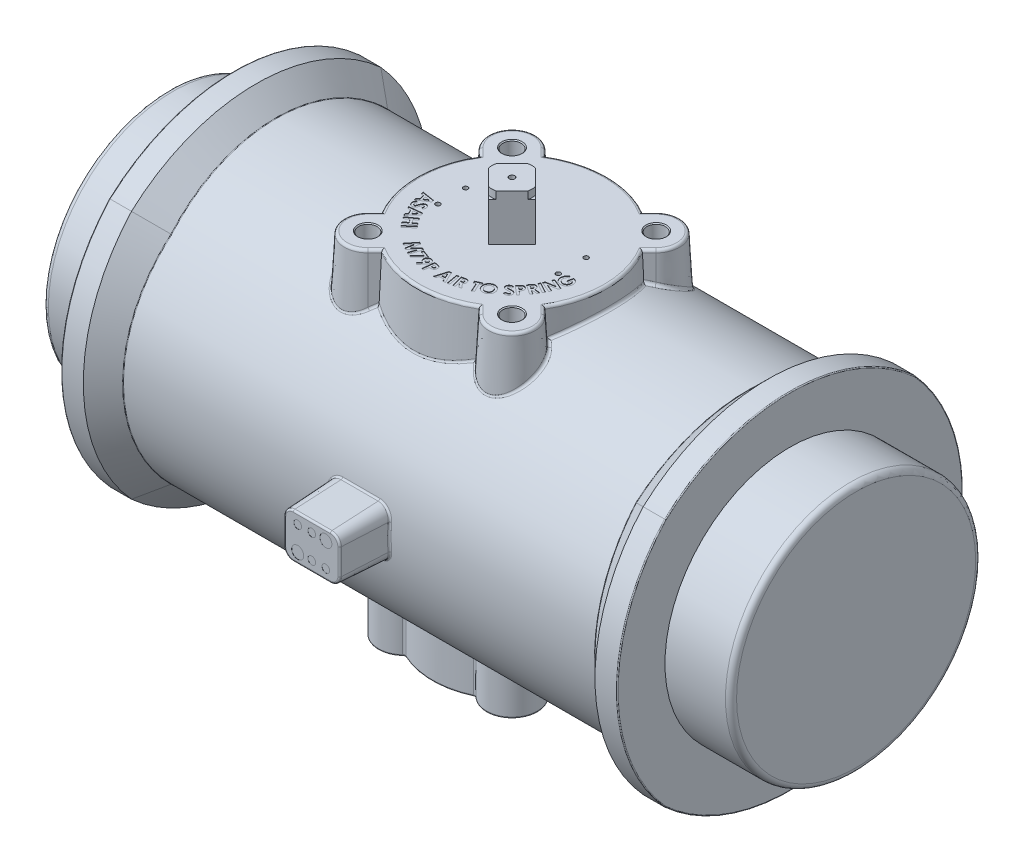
SolidWorks part; units mm, degrees
ref_plane "Front" through (0, 0, 0) normal (0, 0, 1) x (1, 0, 0)
ref_plane "Top" through (0, 0, 0) normal (0, 1, 0) x (1, 0, 0)
ref_plane "Right" through (0, 0, 0) normal (1, 0, 0) x (0, 0, -1)
ref_plane "Plane1" through (300, 0, 0) normal (1, 0, 0) x (0, 0, -1)
sketch "Sketch1" plane through (300, 0, 0) normal (1, 0, 0) x (0, 0, -1)
  line L0 (0, 0) -> (0, 212.9659) construction
  line L1 (0, 0) -> (110.8256, 0) construction
  line L2 (0, 186.5) -> (99.986, 186.5) construction
  line L3 (186.5, 0) -> (186.5, 111.5731) construction
  line L4 (0, 0) -> (-121.6652, 0) construction
  line L5 (0, 0) -> (0, -113.0682) construction
  arc A0 (-134.5102, -134.5102) -> (-134.5102, 134.5102) centre (13.5, 0) cw
  arc A1 (134.5102, -134.5102) -> (134.5102, 134.5102) centre (-13.5, 0) ccw
  arc A2 (134.5102, 134.5102) -> (-134.5102, 134.5102) centre (0, -13.5) ccw
  arc A3 (134.5102, -134.5102) -> (-134.5102, -134.5102) centre (0, 13.5) cw
  dimension "D3" = 200
  dimension "D4" = 400
  dimension "D1" = 186.5
  dimension "D2" = 186.5
extrude "Extrude1" add sketch "Sketch1" against normal blind 24
sketch "Sketch2" plane through (0, 0, 0) normal (1, 0, 0) x (0, 0, -1)
  circle A0 centre (0, 0) radius 165
  dimension "D1" = 330
extrude "Extrude2" add sketch "Sketch2" along normal mid plane 600
mirror "Mirror1" about plane through (0, 0, 0) normal (1, 0, 0) of "Extrude1"
ref_plane "Plane2" through (371.25, 0, 0) normal (1, 0, 0) x (0, 0, -1)
sketch "Sketch3" plane through (371.25, 0, 0) normal (1, 0, 0) x (0, 0, -1)
  circle A0 centre (0, 0) radius 135
  dimension "D1" = 270
extrude "Extrude3" add sketch "Sketch3" against normal blind 71.25
fillet "Fillet1" radius 6 1 edges at (371.25, 0, -135)
mirror "Mirror2" about plane through (0, 0, 0) normal (1, 0, 0) of "Extrude3", "Fillet1"
sketch "Sketch4" plane through (276, 0, 0) normal (-1, 0, 0) x (0, 0, 1)
  arc A0 (-134.5102, 134.5102) -> (-134.5102, -134.5102) centre (13.5, 0) ccw construction
  arc A1 (-134.5102, -134.5102) -> (134.5102, -134.5102) centre (0, 13.5) ccw construction
  arc A2 (134.5102, -134.5102) -> (134.5102, 134.5102) centre (-13.5, 0) ccw construction
  arc A3 (134.5102, 134.5102) -> (-134.5102, 134.5102) centre (0, -13.5) ccw construction
  arc A4 (-134.5102, 134.5102) -> (-134.5102, -134.5102) centre (13.5, 0) ccw
  arc A5 (-134.5102, -134.5102) -> (134.5102, -134.5102) centre (0, 13.5) ccw
  arc A6 (134.5102, -134.5102) -> (134.5102, 134.5102) centre (-13.5, 0) ccw
  arc A7 (134.5102, 134.5102) -> (-134.5102, 134.5102) centre (0, -13.5) ccw
extrude "Extrude5" add sketch "Sketch4" along normal blind 40 draft 45
mirror "Mirror3" about plane through (0, 0, 0) normal (1, 0, 0) of "Extrude5"
fillet "Fillet7" radius 1 16 edges at (300, 0, -186.5) (300, 186.5, 0) (300, 0, 186.5) (300, -186.5, 0) (-300, -186.5, 0) (-300, 0, 186.5) (-300, 186.5, 0) (-300, 0, -186.5) (254.1974, 36.1024, 161.0019) (254.1974, -161.0019, 36.1024) (254.1974, -36.1024, -161.0019) (254.1974, 161.0019, -36.1024) (-254.1974, -161.0019, 36.1024) (-254.1974, 36.1024, 161.0019) (-254.1974, 161.0019, -36.1024) (-254.1974, -36.1024, -161.0019)
ref_plane "Plane3" through (0, -191, 0) normal (0, 1, 0) x (-1, 0, 0)
sketch "Sketch5" plane through (0, -191, 0) normal (0, 1, 0) x (-1, 0, 0)
  line L0 (0, 0) -> (0, 190.8445) construction
  line L1 (0, 0) -> (-388.587, 0) construction
  line L2 (0, 0) -> (-89.9884, 89.9884) construction
  arc A0 (77.9597, -36.3082) -> (77.9597, 36.3082) centre (0, 0) ccw
  circle A1 centre (0, 0) radius 82.5 construction
  arc A2 (-39.6168, 78.4816) -> (-78.4816, 39.6168) centre (-58.3363, 58.3363) ccw
  arc A3 (39.6168, 78.4816) -> (78.4816, 39.6168) centre (58.3363, 58.3363) cw
  arc A4 (-39.6168, -78.4816) -> (-78.4816, -39.6168) centre (-58.3363, -58.3363) cw
  arc A5 (39.6168, -78.4816) -> (78.4816, -39.6168) centre (58.3363, -58.3363) ccw
  arc A6 (36.3082, 77.9597) -> (-36.3082, 77.9597) centre (0, 0) ccw
  arc A7 (-77.9597, 36.3082) -> (-77.9597, -36.3082) centre (0, 0) ccw
  arc A8 (-36.3082, -77.9597) -> (36.3082, -77.9597) centre (0, 0) ccw
  arc A9 (36.3082, 77.9597) -> (39.6168, 78.4816) centre (37.5747, 80.6792) ccw
  arc A10 (77.9597, 36.3082) -> (78.4816, 39.6168) centre (80.6792, 37.5747) cw
  arc A11 (78.4816, -39.6168) -> (77.9597, -36.3082) centre (80.6792, -37.5747) cw
  arc A12 (36.3082, -77.9597) -> (39.6168, -78.4816) centre (37.5747, -80.6792) cw
  arc A13 (-39.6168, -78.4816) -> (-36.3082, -77.9597) centre (-37.5747, -80.6792) cw
  arc A14 (-77.9597, -36.3082) -> (-78.4816, -39.6168) centre (-80.6792, -37.5747) cw
  arc A15 (-78.4816, 39.6168) -> (-77.9597, 36.3082) centre (-80.6792, 37.5747) cw
  arc A16 (-36.3082, 77.9597) -> (-39.6168, 78.4816) centre (-37.5747, 80.6792) cw
  point P20 (38.1904, 77.0551)
  point P29 (-38.1904, -77.0551)
  point P34 (-77.0551, 38.1904)
  point P37 (-38.1904, 77.0551)
  dimension "D1" = 172
  dimension "D2" = 165
  dimension "D4" = 55
  dimension "D5" = 3
  dimension "D3" = 45
extrude "Extrude6" add sketch "Sketch5" along normal up to next
fillet "Fillet8" radius 1.5 16 edges at (0, -191, 86) (38.0421, -191, 77.7159) (77.7817, -191, 77.7817) (77.7159, -191, 38.0421) (86, -191, 0) (77.7159, -191, -38.0421) (77.7817, -191, -77.7817) (38.0421, -191, -77.7159) (0, -191, -86) (-38.0421, -191, -77.7159) (-77.7817, -191, -77.7817) (-77.7159, -191, -38.0421) (-86, -191, 0) (-77.7159, -191, 38.0421) (-77.7817, -191, 77.7817) (-38.0421, -191, 77.7159)
fillet "Fillet9" radius 3 16 edges at (-37.9049, -145.5613, 77.6975) (-73.6372, -143.6445, 81.1866) (-77.7752, -160.4868, 38.3276) (-85.2676, -164.6195, -11.1995) (-77.6853, -160.6199, -37.7657) (-77.7278, -145.4875, -77.8356) (-38.0776, -145.5484, -77.7217) (11.7776, -141.3072, -85.1897) (37.9049, -145.5613, -77.6975) (73.6372, -143.6445, -81.1866) (77.7752, -160.4868, -38.3276) (85.2676, -164.6195, 11.1995) (77.6853, -160.6199, 37.7657) (38.0776, -145.5484, 77.7217) (77.7278, -145.4875, 77.8356) (-11.7776, -141.3072, 85.1897)
sketch "Sketch6" plane through (0, -191, 0) normal (0, -1, 0) x (1, 0, 0)
  line L0 (0, 0) -> (97.1887, 0) construction
  line L1 (0, 0) -> (0, 94.8232) construction
  line L2 (0, 0) -> (86.5029, 86.5029) construction
  circle A0 centre (0, 0) radius 82.5 construction
  circle A1 centre (58.3363, 58.3363) radius 10
  circle A2 centre (-58.3363, 58.3363) radius 10
  circle A3 centre (-58.3363, -58.3363) radius 10
  circle A4 centre (58.3363, -58.3363) radius 10
  dimension "D1" = 165
  dimension "D3" = 20
  dimension "D2" = 45
extrude "Cut-Extrude1" cut sketch "Sketch6" against normal blind 40
chamfer "Chamfer1" distance 1 angle 45 4 edges at (-58.3363, -191, -68.3363) (58.3363, -191, -48.3363) (58.3363, -191, 48.3363) (-58.3363, -191, 68.3363)
sketch "Sketch7" plane through (0, -191, 0) normal (0, -1, 0) x (1, 0, 0)
  line L0 (0, 0) -> (0, 54.3411) construction
  line L1 (0, 0) -> (-43.8278, 0) construction
  line L2 (0, 0) -> (-30.8815, 30.8815) construction
  line L3 (-23, 20.0312) -> (-23, 9.5269)
  line L4 (23, 20.0312) -> (23, 9.5269)
  line L5 (-30.4277, -2.0992) -> (-23, -9.5269)
  line L6 (2.0992, 30.4277) -> (9.5269, 23)
  line L7 (30.4277, -2.0992) -> (23, -9.5269)
  line L8 (-2.0992, 30.4277) -> (-9.5269, 23)
  line L9 (-20.0312, 23) -> (-9.5269, 23)
  line L10 (-20.0312, -23) -> (-9.5269, -23)
  line L11 (9.5269, 23) -> (20.0312, 23)
  line L12 (-9.5269, -23) -> (-2.0992, -30.4277)
  line L13 (9.5269, -23) -> (2.0992, -30.4277)
  line L14 (23, 9.5269) -> (30.4277, 2.0992)
  line L15 (23, -9.5269) -> (23, -20.0312)
  line L16 (9.5269, -23) -> (20.0312, -23)
  line L17 (-23, -9.5269) -> (-23, -20.0312)
  line L18 (-23, 9.5269) -> (-30.4277, 2.0992)
  line L19 (0, 0) -> (32.2779, 32.2779) construction
  arc A1 (-20.0312, 23) -> (-23, 20.0312) centre (0, 0) ccw
  arc A2 (2.0992, 30.4277) -> (-2.0992, 30.4277) centre (0, 0) ccw
  arc A3 (23, 20.0312) -> (20.0312, 23) centre (0, 0) ccw
  arc A4 (30.4277, -2.0992) -> (30.4277, 2.0992) centre (0, 0) ccw
  arc A5 (20.0312, -23) -> (23, -20.0312) centre (0, 0) ccw
  arc A6 (-2.0992, -30.4277) -> (2.0992, -30.4277) centre (0, 0) ccw
  arc A7 (-23, -20.0312) -> (-20.0312, -23) centre (0, 0) ccw
  arc A8 (-30.4277, 2.0992) -> (-30.4277, -2.0992) centre (0, 0) ccw
  dimension "D1" = 61
  dimension "D2" = 45
  dimension "D3" = 46
  dimension "D4" = 46
  dimension "D5" = 46
  dimension "D6" = 46
  dimension "D7" = 45
extrude "Cut-Extrude2" cut sketch "Sketch7" against normal blind 52
sketch "Sketch8" plane through (0, -191, 0) normal (0, -1, 0) x (1, 0, 0)
  circle A0 centre (0, 0) radius 60.2157
  circle A1 centre (0, 0) radius 59.2157
  dimension "D1" = 1
extrude "Cut-Extrude3" cut sketch "Sketch8" against normal blind 15
ref_plane "Plane4" through (0, 237, 0) normal (0, 1, 0) x (-1, 0, 0)
sketch "Sketch9" plane through (0, 237, 0) normal (0, 1, 0) x (-1, 0, 0)
  line L0 (0, 0) -> (0, -193.1962) construction
  line L1 (0, 0) -> (-387.8165, 0) construction
  line L2 (0, -25.4558) -> (-25.4558, 0)
  line L3 (25.4558, 0) -> (0, 25.4558)
  line L4 (0, 25.4558) -> (-25.4558, 0)
  line L5 (25.4558, 0) -> (0, -25.4558)
  line L6 (0, 0) -> (-60.0997, -60.0997) construction
  line L7 (0, 0) -> (49.1238, -49.1238) construction
  dimension "D1" = 45
  dimension "D2" = 36
extrude "Extrude8" add sketch "Sketch9" against normal up to body separate body
ref_plane "Plane5" through (0, 187, 0) normal (0, 1, 0) x (-1, 0, 0)
sketch "Sketch10" plane through (0, 187, 0) normal (0, 1, 0) x (-1, 0, 0)
  line L0 (0, 0) -> (-99.6835, 99.6835) construction
  line L1 (0, 0) -> (-131.4873, 0) construction
  line L2 (0, 0) -> (0, 199.3671) construction
  line L3 (0, 0) -> (0, -179.9051) construction
  line L4 (0, 0) -> (139.0823, 0) construction
  line L5 (-95.4594, 60.1041) -> (-87.9672, 52.6119)
  line L6 (-60.1041, 95.4594) -> (-52.6119, 87.9672)
  line L7 (60.1041, 95.4594) -> (52.6119, 87.9672)
  line L8 (95.4594, 60.1041) -> (87.9672, 52.6119)
  line L9 (95.4594, -60.1041) -> (87.9672, -52.6119)
  line L10 (60.1041, -95.4594) -> (52.6119, -87.9672)
  line L11 (-60.1041, -95.4594) -> (-52.6119, -87.9672)
  line L12 (-95.4594, -60.1041) -> (-87.9672, -52.6119)
  arc A0 (-52.6119, -87.9672) -> (52.6119, -87.9672) centre (0, 0) ccw
  circle A1 centre (0, 0) radius 110 construction
  arc A2 (-60.1041, 95.4594) -> (-95.4594, 60.1041) centre (-77.7817, 77.7817) ccw
  arc A3 (60.1041, 95.4594) -> (95.4594, 60.1041) centre (77.7817, 77.7817) cw
  arc A4 (60.1041, -95.4594) -> (95.4594, -60.1041) centre (77.7817, -77.7817) ccw
  arc A5 (-60.1041, -95.4594) -> (-95.4594, -60.1041) centre (-77.7817, -77.7817) cw
  arc A6 (-87.9672, 52.6119) -> (-87.9672, -52.6119) centre (0, 0) ccw
  arc A7 (52.6119, 87.9672) -> (-52.6119, 87.9672) centre (0, 0) ccw
  arc A8 (87.9672, -52.6119) -> (87.9672, 52.6119) centre (0, 0) ccw
  dimension "D1" = 205
  dimension "D2" = 220
  dimension "D4" = 50
  dimension "D3" = 45
extrude "Extrude9" add sketch "Sketch10" against normal up to next draft 3
fillet "Fillet10" radius 3 32 edges at (5.5169, 126.8587, 105.5077) (0, 187, 102.5) (56.358, 187, 91.7133) (91.7133, 187, 56.358) (91.7133, 187, -56.358) (56.358, 187, -91.7133) (-56.358, 187, -91.7133) (-91.7133, 187, -56.358) (-91.7133, 187, 56.358) (-56.358, 187, 91.7133) (55.1786, 135.3547, 94.3616) (93.3359, 155.3379, 55.6339) (103.2403, 164.7322, -9.3964) (0, 187, -102.5) (-102.5, 187, 0) (95.4594, 187, 95.4594) (102.5, 187, 0) (95.4594, 187, -95.4594) (-95.4594, 187, -95.4594) (-95.4594, 187, 95.4594) (63.6964, 155.5077, 55.1576) (-93.3359, 155.3379, 55.6339) (-55.1786, 135.3547, 94.3616) (-55.1786, 135.3547, -94.3616) (-93.3359, 155.3379, -55.6339) (93.3359, 155.3379, -55.6339) (55.1786, 135.3547, -94.3616) (-103.2403, 164.7322, 9.3964) (-59.5305, 154.3648, 58.2796) (-64.4122, 155.6564, -54.7365) (-5.5169, 126.8587, -105.5077) (58.8714, 154.1289, -58.9005)
sketch "Sketch11" plane through (0, 237, 0) normal (0, 1, 0) x (1, 0, 0)
  circle A0 centre (0, 0) radius 21.75
  dimension "D1" = 43.5
extrude "Cut-Extrude4" cut sketch "Sketch11" against normal blind 8 flip side to cut
sketch "Sketch12" plane through (0, 187, 0) normal (0, 1, 0) x (1, 0, 0)
  line L0 (0, 0) -> (0, 184.6519) construction
  line L1 (0, 0) -> (386.8671, 0) construction
  line L3 (-65, 15) -> (65, 15) construction
  line L4 (-65, 15) -> (-65, -15) construction
  line L5 (-65, -15) -> (65, -15) construction
  line L6 (65, 15) -> (65, -15) construction
  circle A0 centre (65, 15) radius 2.5006
  circle A1 centre (-65, 15) radius 2.5006
  circle A2 centre (-65, -15) radius 2.5006
  circle A3 centre (65, -15) radius 2.5006
  point P8 (0, 15)
  point P9 (65, 0)
  dimension "D3" = 5.0013
  dimension "D1" = 30
  dimension "D2" = 130
extrude "Cut-Extrude5" cut sketch "Sketch12" against normal blind 10
sketch "Sketch13" plane through (0, 187, 0) normal (0, 1, 0) x (1, 0, 0)
  circle A0 centre (0, 0) radius 110 construction
  circle A1 centre (77.7817, 77.7817) radius 10
  circle A2 centre (-77.7817, 77.7817) radius 10
  circle A3 centre (-77.7817, -77.7817) radius 10
  circle A4 centre (77.7817, -77.7817) radius 10
  dimension "D1" = 220
  dimension "D2" = 20
extrude "Cut-Extrude6" cut sketch "Sketch13" against normal blind 22
chamfer "Chamfer2" distance 1 angle 45 4 edges at (77.7817, 187, -67.7817) (77.7817, 187, 87.7817) (-77.7817, 187, 87.7817) (-77.7817, 187, -67.7817)
ref_plane "Plane6" through (0, 0, 216) normal (0, 0, 1) x (1, 0, 0)
sketch "Sketch14" plane through (0, 0, 216) normal (0, 0, 1) x (1, 0, 0)
  line L0 (0, 0) -> (0, 103.485) construction
  line L1 (0, 0) -> (129.8846, 0) construction
  line L3 (-20, 24) -> (20, 24)
  line L4 (-30, 14) -> (-30, -14)
  line L5 (-20, -24) -> (20, -24)
  line L6 (30, 14) -> (30, -14)
  arc A0 (-20, 24) -> (-30, 14) centre (-20, 14) ccw
  arc A1 (30, 14) -> (20, 24) centre (20, 14) ccw
  arc A2 (20, -24) -> (30, -14) centre (20, -14) ccw
  arc A3 (-30, -14) -> (-20, -24) centre (-20, -14) ccw
  point P10 (-30, 24)
  point P13 (30, 24)
  point P18 (-30, -24)
  dimension "D3" = 10
  dimension "D1" = 48
  dimension "D2" = 60
extrude "Extrude10" add sketch "Sketch14" against normal up to next draft 3
sketch "Sketch15" plane through (0, 0, 216) normal (0, 0, 1) x (1, 0, 0)
  line L0 (0, 0) -> (-46.1592, 0) construction
  line L1 (0, 0) -> (0, 33.8806) construction
  circle A0 centre (-15.1848, 12.9763) radius 4.16
  circle A1 centre (0, 12.9763) radius 4.1618
  circle A2 centre (15.1848, 12.9763) radius 6.5
  circle A3 centre (-15.1848, -12.9763) radius 6.5
  circle A4 centre (0, -12.9763) radius 4.1618
  circle A5 centre (15.1848, -12.9763) radius 4.16
  dimension "D1" = 8.3237
  dimension "D2" = 13
  dimension "D3" = 8.32
extrude "Cut-Extrude7" cut sketch "Sketch15" against normal blind 0.1
fillet "Fillet11" radius 2 16 edges at (29.9275, 22.0005, 163.5267) (32.6728, 0, 165) (27.8512, -24.0653, 163.2356) (0, -26.7875, 162.811) (-29.9275, -22.0005, 163.5267) (27.0711, 21.0711, 216) (30, 0, 216) (27.0711, -21.0711, 216) (0, -24, 216) (-27.0711, -21.0711, 216) (-32.6728, 0, 165) (-27.8512, 24.0653, 163.2356) (-27.0711, 21.0711, 216) (-30, 0, 216) (0, 26.7875, 162.811) (0, 24, 216)
sketch "Sketch16" plane through (0, 237, 0) normal (0, 1, 0) x (1, 0, 0)
  circle A0 centre (0, 0) radius 2.9997
  dimension "D1" = 5.9995
extrude "Cut-Extrude8" cut sketch "Sketch16" against normal blind 12
sketch "Sketch17"
  dimension "D1" = 170
extrude "Cut-Extrude9" cut sketch "Sketch17" against normal blind 0.5
